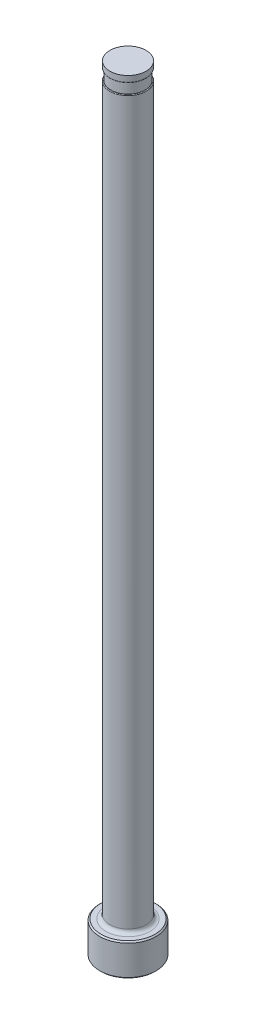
SolidWorks part; units mm, degrees
ref_plane "Front Plane" through (0, 0, 0) normal (0, 0, 1) x (1, 0, 0)
ref_plane "Top Plane" through (0, 0, 0) normal (0, 1, 0) x (1, 0, 0)
ref_plane "Right Plane" through (0, 0, 0) normal (1, 0, 0) x (0, 0, -1)
other "Configuration Table"
sketch "Sketch1" plane through (0, 0, 0) normal (0, 0, 1) x (1, 0, 0)
  line L0 (0, 259.9588) -> (0, -15.1925) construction
  line L1 (0, 0) -> (-5.5499, 0)
  line L2 (-5.5499, 0) -> (-5.5499, 6.35)
  line L3 (-5.5499, 6.35) -> (-3.5712, 6.35)
  line L4 (-3.5712, 6.35) -> (-3.5712, 152.4)
  line L5 (-3.5712, 152.4) -> (0, 152.4)
  line L6 (0, 152.4) -> (0, 0)
  dimension "L" = 152.4
  dimension "H" = 11.0998
  dimension "T" = 6.35
  dimension "D" = 7.1425
revolve "Revolve1" add sketch "Sketch1" angle 360 about L0
chamfer "Chamfer1" distance 0.254 angle 45 2 edges at (0, 6.35, 5.5499) (0, 0, 5.5499)
fillet "Fillet1" radius 0.762 1 edges at (0, 6.35, 3.5712)
sketch "Sketch2" plane through (0, 0, 0) normal (0, 0, 1) x (1, 0, 0)
  line L0 (-3.5712, 152.4) -> (-3.5712, 7.112) construction
  line L1 (-3.5712, 151.13) -> (-3.368, 151.13)
  line L2 (-3.5712, 151.13) -> (-3.5712, 149.098)
  line L3 (-3.5712, 149.098) -> (-3.368, 149.098)
  line L4 (-3.368, 151.13) -> (-3.368, 149.098)
  line L5 (3.5712, 152.4) -> (-3.5712, 152.4) construction
  line L6 (0, 153.4483) -> (0, 147.3282) construction
  dimension "D1" = 2.032
  dimension "N" = 1.27
  dimension "FD" = 0.2032
  dimension "D3" = 6.7361
revolve "Vent Relief" cut sketch "Sketch2" angle 360 about L6
sketch "Sketch3" plane through (0, 0, 0) normal (0, 0, 1) x (1, 0, 0)
  line L0 (-3.368, 150.114) -> (-3.368, 86.614)
  line L1 (-3.368, 151.13) -> (-3.368, 149.098) construction
  line L2 (-3.5712, 149.098) -> (-3.5712, 7.112) construction
  line L3 (-3.5712, 85.4964) -> (-3.5712, 150.114)
  line L4 (-3.5712, 150.114) -> (-3.368, 150.114)
  arc A0 (-3.368, 86.614) -> (-3.5712, 85.4964) centre (-6.543, 86.614) cw
  dimension "D1" = 3.175
  dimension "D2" = 63.5
extrude "D-Slot" cut sketch "Sketch3" against normal through all both and the other way through all
sketch "Sketch5" plane through (0, 0, 0) normal (0, 0, 1) x (1, 0, 0)
  line L0 (-3.5712, 151.13) -> (3.5712, 151.13) construction
  line L1 (-3.5712, 152.4) -> (-3.5522, 152.4)
  line L2 (-3.5712, 152.4) -> (-3.5712, 151.13)
  line L3 (-3.5712, 151.13) -> (-3.5522, 151.13)
  line L4 (-3.5522, 152.4) -> (-3.5522, 151.13)
  line L5 (0, 152.6877) -> (0, 150.5771) construction
  dimension "VP" = 0.019
revolve "Vent Diameter" cut sketch "Sketch5" angle 360 about L5
fillet "Fillet2" radius 0.127 2 edges at (3.5712, 149.098, 0) (0, 151.13, 3.5522)
sketch "Pocket Sketch" plane through (0, 0, 0) normal (0, 0, 1) x (1, 0, 0)
  line L0 (-5.9468, 0) -> (-5.9468, 6.3754)
  line L1 (-5.9468, 6.3754) -> (-4.5317, 6.3754)
  line L2 (-3.7697, 7.1374) -> (-3.7697, 22.225)
  line L3 (-3.7697, 22.225) -> (0, 22.225)
  line L4 (0, 22.225) -> (0, 0)
  line L5 (0, 0) -> (-5.9468, 0)
  line L6 (0, 12.6104) -> (0, -2.4989) construction
  line L7 (-5.5499, 6.096) -> (-5.5499, 0.254) construction
  line L8 (5.2959, 6.35) -> (-5.2959, 6.35) construction
  line L9 (-3.5712, 85.4964) -> (-3.5712, 7.112) construction
  line L10 (-4.5317, 6.3754) -> (-3.7697, 7.1374)
  point P3 (-3.7697, 6.3754)
  dimension "D1" = 11.8935
  dimension "D2" = 0.3969
  dimension "D3" = 0.0254
  dimension "D4" = 0.1984
  dimension "D5" = 7.5394
  dimension "D6" = 22.225
